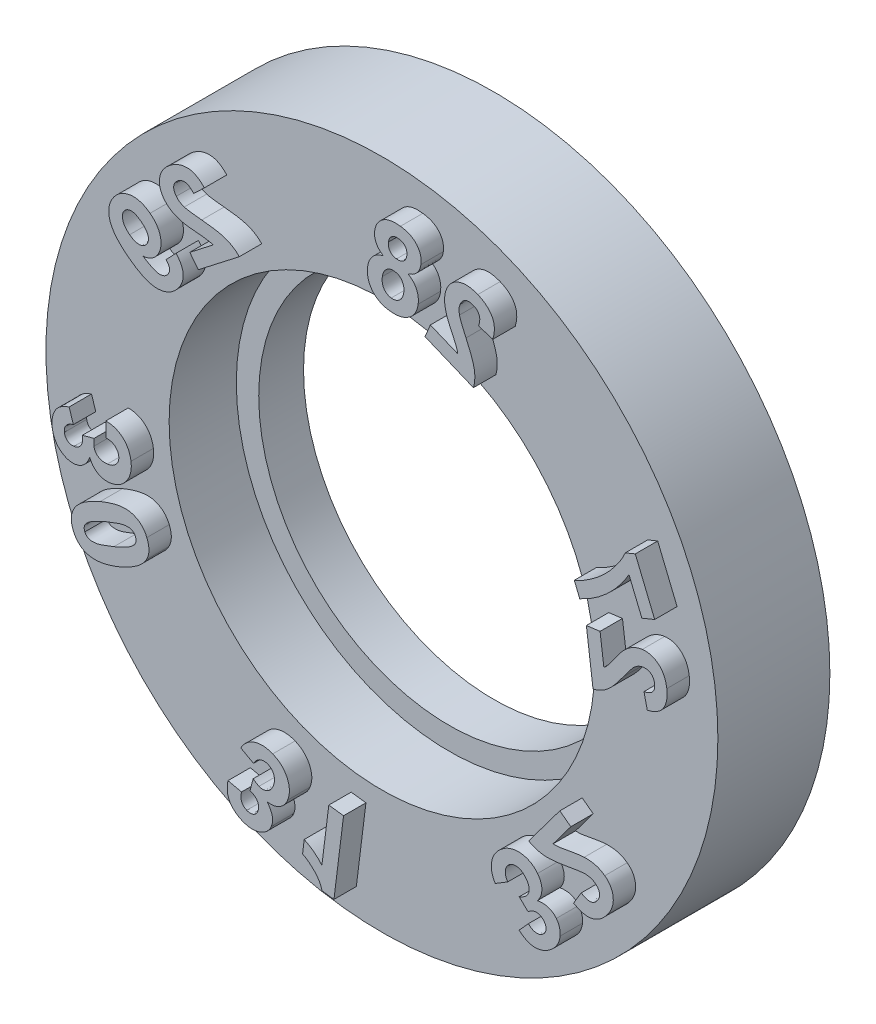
SolidWorks part; units mm, degrees
ref_plane "Front Plane" through (0, 0, 0) normal (0, 0, 1) x (1, 0, 0)
ref_plane "Top Plane" through (0, 0, 0) normal (0, 1, 0) x (1, 0, 0)
ref_plane "Right Plane" through (0, 0, 0) normal (1, 0, 0) x (0, 0, -1)
imported_body "Imported1"
other "DeleteFace3"
sketch "Sketch1" plane through (0, 0, 0) normal (0, 0, 1) x (1, 0, 0)
  circle A0 centre (0, 0) radius 10.4416 construction
  text T0 "27    28    29    30    31    32" font "Arial" height 3.5
extrude "Boss-Extrude1" add sketch "Sketch1" along normal blind 1
